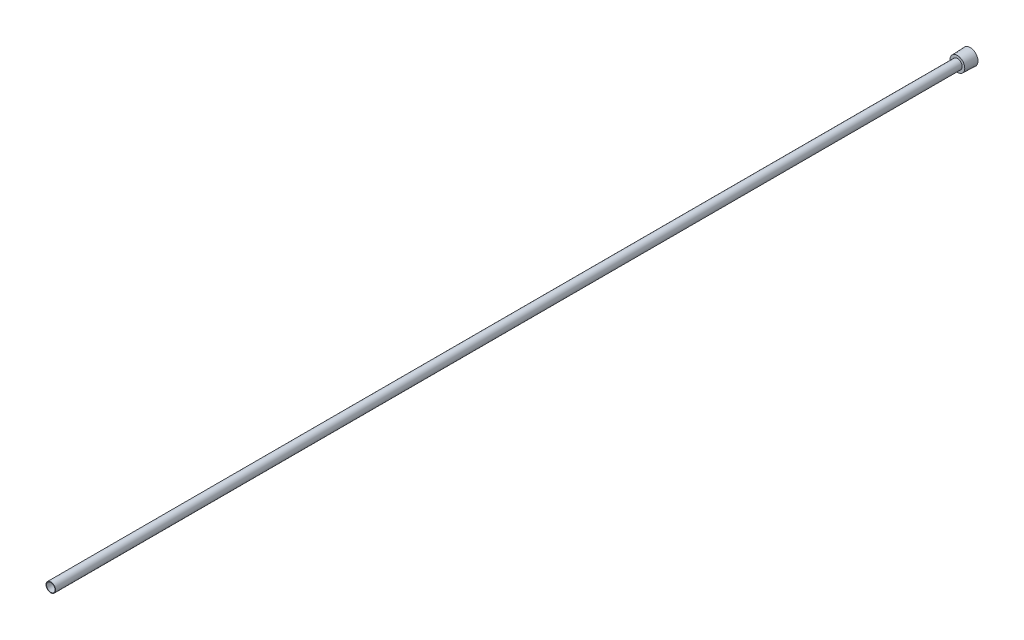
SolidWorks part; units mm, degrees
ref_plane "Front Plane" through (0, 0, 0) normal (0, 0, 1) x (1, 0, 0)
ref_plane "Top Plane" through (0, 0, 0) normal (0, 1, 0) x (1, 0, 0)
ref_plane "Right Plane" through (0, 0, 0) normal (1, 0, 0) x (0, 0, -1)
sketch "Sketch1" plane through (0, 0, 0) normal (1, 0, 0) x (0, 0, -1)
  line L0 (-457.2, 0) -> (0, 0)
  line L5 (0, 3.8989) -> (-6.35, 3.6674)
  line L6 (0, 0) -> (0, 3.8989)
  line L7 (-6.35, 3.6674) -> (-6.35, 2.3749)
  line L8 (-6.35, 2.3749) -> (-457.2, 2.3749)
  line L9 (-457.2, 2.3749) -> (-457.2, 0)
  line L10 (0, 0) -> (49989.3417, 0) construction
  dimension "D1" = 2.088
  dimension "D2" = 6.35
  dimension "D3" = 457.2
  dimension "D4" = 4.7498
  dimension "D5" = 7.7978
revolve "Revolve1" add sketch "Sketch1" angle 360 about L10
sketch "Sketch2" plane through (0, 0, 457.2) normal (0, 0, 1) x (1, 0, 0)
  circle A0 centre (0, 0) radius 2.1209
  dimension "D1" = 4.2418
extrude "Cut-Extrude1" cut sketch "Sketch2" against normal through all
sketch "Sketch3" plane through (0, 0, 0) normal (0, 0, -1) x (-1, 0, 0)
  line L0 (0, 4.2888) -> (0, -4.2888) construction
  line L1 (0, -2.7496) -> (2.3812, -1.3748)
  line L2 (2.3812, -1.3748) -> (2.3812, 1.3748)
  line L3 (2.3812, 1.3748) -> (0, 2.7496)
  line L4 (0, 2.7496) -> (-2.3813, 1.3748)
  line L5 (-2.3813, 1.3748) -> (-2.3813, -1.3748)
  line L6 (-2.3813, -1.3748) -> (0, -2.7496)
  circle A0 centre (0, 0) radius 2.3813 construction
  dimension "D1" = 4.7625
extrude "Cut-Extrude2" cut sketch "Sketch3" against normal blind 3.9688
